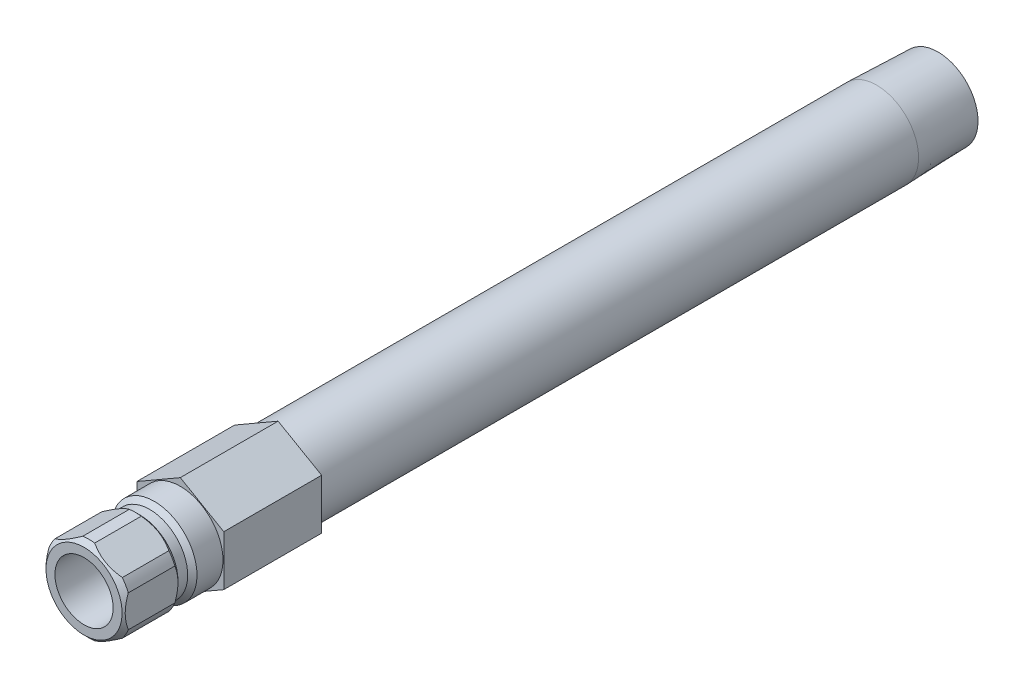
SolidWorks part; units mm, degrees
ref_plane "Front Plane" through (0, 0, 0) normal (0, 0, 1) x (1, 0, 0)
ref_plane "Top Plane" through (0, 0, 0) normal (0, 1, 0) x (1, 0, 0)
ref_plane "Right Plane" through (0, 0, 0) normal (1, 0, 0) x (0, 0, -1)
sketch "Sketch1" plane through (0, 0, 0) normal (1, 0, 0) x (0, 0, -1)
  line L0 (-12.8748, 0) -> (-18.923, 0) construction
  line L1 (-15.748, 4.7625) -> (-15.748, 6.223)
  line L2 (-6.604, 6.223) -> (-6.604, 0) construction
  line L3 (-14.986, 6.985) -> (-7.366, 6.985)
  line L4 (-3.556, 4.7625) -> (-3.556, 6.858) construction
  line L5 (-6.604, 6.223) -> (-5.0165, 6.223)
  line L6 (-4.2545, 6.985) -> (0, 6.985)
  line L7 (0, 6.985) -> (0, 6.858)
  line L8 (-6.604, 6.223) -> (-7.366, 6.985)
  line L9 (-5.0165, 6.223) -> (-4.2545, 6.985)
  line L10 (-15.748, 6.223) -> (-14.986, 6.985)
  line L11 (-15.748, 4.7625) -> (-3.556, 4.7625)
  line L12 (0, 6.858) -> (113.919, 6.858)
  line L13 (113.919, 6.858) -> (123.952, 6.5445)
  line L14 (123.952, 6.5445) -> (123.952, 4.6228)
  line L15 (-3.556, 4.7625) -> (-3.4817, 4.6228)
  line L16 (16.002, 6.858) -> (16.002, 0) construction
  line L17 (16.002, 0) -> (-12.8748, 0) construction
  line L19 (-3.4817, 4.6228) -> (123.952, 4.6228)
  dimension "D1" = 15.748
  dimension "D2" = 1.5875
  dimension "D3" = 0.762
  dimension "D4" = 45
  dimension "D5" = 9.144
  dimension "D6" = 45
  dimension "D7" = 1.79
  dimension "D8" = 10.033
  dimension "D9" = 139.7
  dimension "D10" = 3.175
  dimension "D11" = 9.525
  dimension "D12" = 13.716
  dimension "D13" = 31.75
  dimension "D14" = 13.97
  dimension "D15" = 9.2456
  dimension "D17" = 118
  dimension "D18" = 12.192
revolve "Revolve1" add sketch "Sketch1" angle 360 about L0
sketch "Sketch2" plane through (0, 0, 0) normal (0, 0, 1) x (1, 0, 0)
  line L1 (-7.112, 4.1061) -> (-7.112, -4.1061)
  line L2 (-7.112, -4.1061) -> (0, -8.2122)
  line L3 (0, -8.2122) -> (7.112, -4.1061)
  line L4 (7.112, -4.1061) -> (7.112, 4.1061)
  line L5 (7.112, 4.1061) -> (0, 8.2122)
  line L6 (0, 8.2122) -> (-7.112, 4.1061)
  circle A0 centre (0, 0) radius 7.112 construction
  circle A1 centre (0, 0) radius 4.6228 construction
  circle A2 centre (0, 0) radius 4.6228
  dimension "D1" = 14.224
extrude "Boss-Extrude1" add sketch "Sketch2" against normal up to vertex (16.002 mm away)
sketch "Sketch3" plane through (0, 0, 0) normal (0, 0, 1) x (1, 0, 0)
  line L1 (6.477, -3.7395) -> (6.477, 3.7395)
  line L2 (6.477, 3.7395) -> (0, 7.479)
  line L3 (0, 7.479) -> (-6.477, 3.7395)
  line L4 (-6.477, 3.7395) -> (-6.477, -3.7395)
  line L5 (-6.477, -3.7395) -> (0, -7.479)
  line L6 (0, -7.479) -> (6.477, -3.7395)
  circle A0 centre (0, 0) radius 6.477 construction
  dimension "D1" = 12.954
extrude "Cut-Extrude1" cut sketch "Sketch3" along normal through all from vertex at 6.604 flip side to cut
